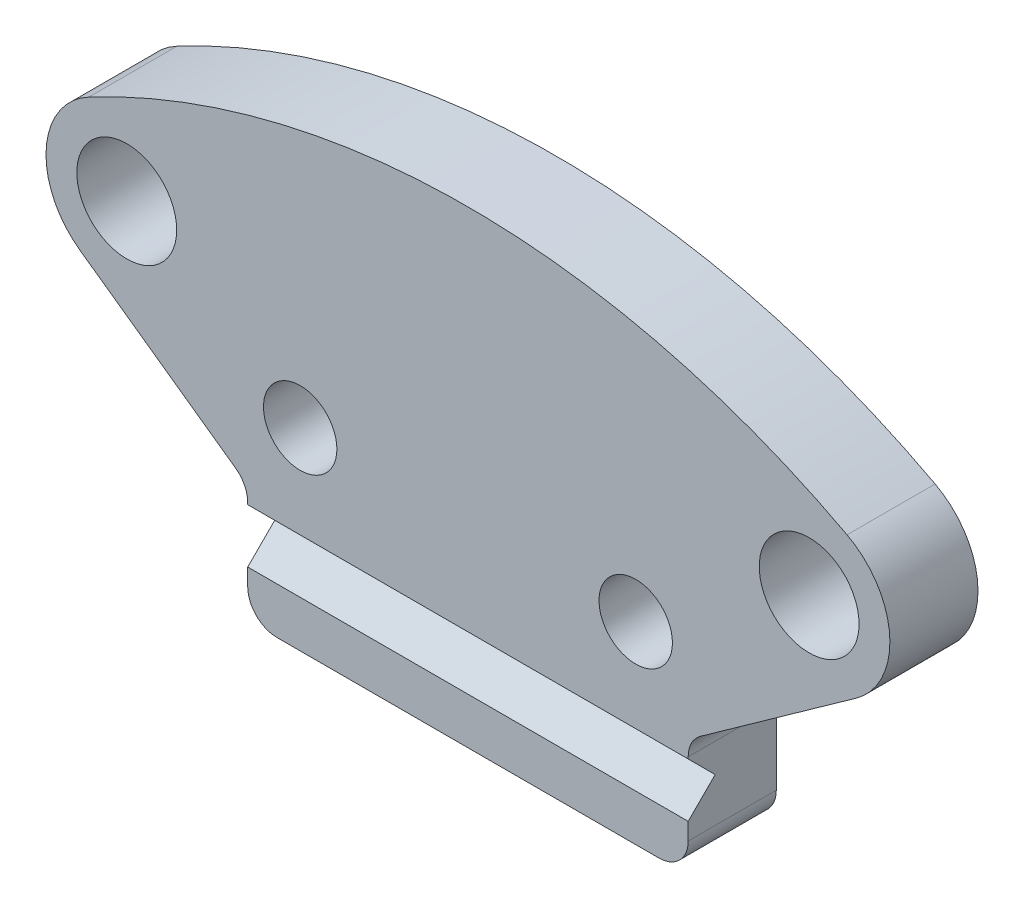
SolidWorks part; units mm, degrees
ref_plane "Plan de face" through (0, 0, 0) normal (0, 0, 1) x (1, 0, 0)
ref_plane "Plan de dessus" through (0, 0, 0) normal (0, 1, 0) x (1, 0, 0)
ref_plane "Plan de droite" through (0, 0, 0) normal (1, 0, 0) x (0, 0, -1)
sketch "Esquisse1" plane through (0, 0, 0) normal (0, 0, 1) x (1, 0, 0)
  line L4 (0, 0) -> (0, 32.9425) construction
  line L5 (10.7404, 15.6876) -> (15.7529, 22.8462)
  line L6 (9.5903, 14.045) -> (15.6378, 22.6818)
  line L7 (-9.5903, 14.045) -> (-15.6378, 22.6818)
  line L8 (-9.5903, 14.045) -> (-9.5903, 11.545)
  line L9 (-9.5903, 11.545) -> (9.5903, 11.545)
  line L10 (9.5903, 11.545) -> (9.5903, 14.045)
  circle A0 centre (11.6194, 21.853) radius 1.7 construction
  circle A1 centre (-11.6194, 21.853) radius 1.7 construction
  circle A2 centre (11.6194, 21.853) radius 1.7
  circle A3 centre (-11.6194, 21.853) radius 1.7
  arc A5 (15.9167, 22.7315) -> (-15.9167, 22.7315) centre (0, 0) ccw construction
  arc A7 (15.6378, 22.6818) -> (-15.6378, 22.6818) centre (0, 0) ccw
  dimension "D2" = 0.2
  dimension "D3" = 2.5
  dimension "D4" = 19.1805
  dimension "D1" = 0.2
extrude "Boss.-Extru.1" add sketch "Esquisse1" along normal blind 3
hole_wizard "Trou taraudé M31" positions "Esquisse2" profile "Esquisse3" tap size "M3" standard "ISO"
sketch "Esquisse2" plane through (0, 0, 3) normal (0, 0, 1) x (1, 0, 0)
  point P0 (5.7134, 18.1206)
  point P2 (-5.7134, 18.1206)
sketch "Esquisse3" plane through (5.7134, 18.1206, 3) normal (1, 0, 0) x (0, -1, 0)
  line L0 (0, 0) -> (0, 3)
  line L1 (0, 3) -> (1.25, 3)
  line L2 (1.25, 3) -> (1.25, 0)
  line L5 (1.25, 0) -> (0, 0)
  line L11 (0, -6.35) -> (0, 107.95) construction
  dimension "Diamètre du trou pour taraudage jusqu'au prochain" = 2.5
  dimension "Profondeur du trou pour taraudage jusqu'au prochain" = 3
sketch "Esquisse4" plane through (-9.5903, 0, 0) normal (-1, 0, 0) x (0, 0, 1)
  line L0 (3, 14.045) -> (3, 11.545) construction
  line L1 (3, 14.9642) -> (2.0808, 14.045)
  line L2 (2.0808, 14.045) -> (3, 13.1258)
  line L3 (3, 14.045) -> (4.2544, 14.045) construction
  line L4 (3, 14.9642) -> (3, 13.1258)
  line L5 (3, 14.045) -> (0, 14.045) construction
  circle A0 centre (3, 14.045) radius 0.65 construction
  dimension "D1" = 1.3
  dimension "D2" = 0
extrude "Enlèv. mat.-Extru.1" cut sketch "Esquisse4" against normal through all both and the other way through all
fillet "Congé1" radius 2 2 edges at (15.6378, 22.6818, 1.5) (-15.6378, 22.6818, 1.5)
sketch "Esquisse5" plane through (0, 0, 3) normal (0, 0, 1) x (1, 0, 0)
  line L0 (-13.2142, 19.6126) -> (-7.5, 15.545)
  line L1 (-7.5, 15.545) -> (-7.5, 11.545)
  line L2 (-9.5903, 11.545) -> (9.5903, 11.545) construction
  line L3 (0, 0) -> (0, 32.5558) construction
  line L4 (7.5, 15.545) -> (7.5, 11.545)
  line L5 (13.2142, 19.6126) -> (7.5, 15.545)
  line L6 (-7.5, 11.545) -> (-25.0143, 11.545)
  line L7 (7.5, 11.545) -> (25.0143, 11.545)
  circle A0 centre (-11.6194, 21.853) radius 2.75 construction
  arc A1 (-12.9105, 24.2811) -> (-13.2142, 19.6126) centre (-11.6194, 21.853) ccw
  circle A2 centre (11.6194, 21.853) radius 2.75 construction
  arc A3 (13.2142, 19.6126) -> (12.9105, 24.2811) centre (11.6194, 21.853) ccw
  arc A6 (25.0143, 11.545) -> (-25.0143, 11.545) centre (0, 0) ccw
  arc A7 (12.9105, 24.2811) -> (-12.9105, 24.2811) centre (0, 0) ccw
  arc A8 (13.8001, 23.8445) -> (-13.8001, 23.8445) centre (0, 0) ccw construction
  point P24 (26.2984, 8.0402)
  dimension "D1" = 15
  dimension "D2" = 4
extrude "Enlèv. mat.-Extru.2" cut sketch "Esquisse5" against normal through all and the other way through all
fillet "Congé2" radius 1 4 edges at (7.5, 15.545, 1.5) (7.5, 11.545, 1.5) (-7.5, 11.545, 1.5) (-7.5, 15.545, 1.5)
